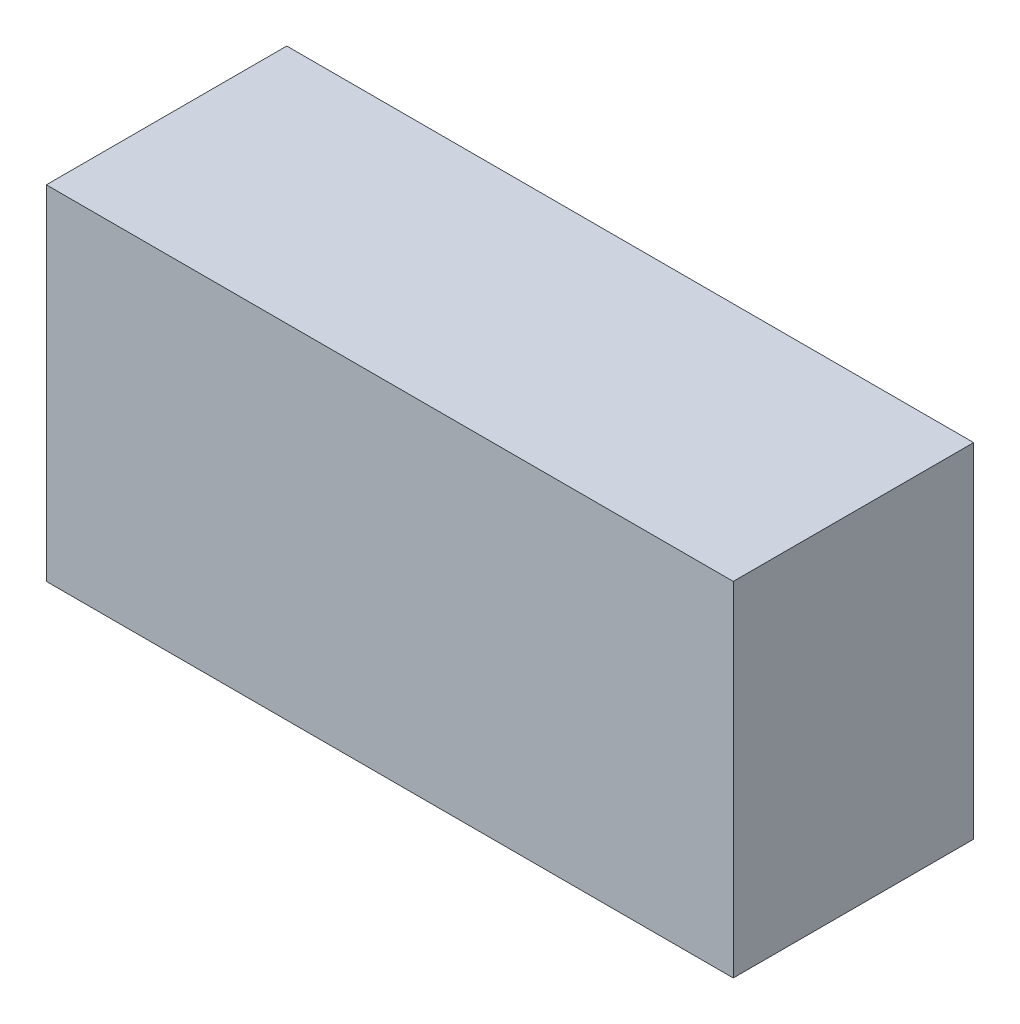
SolidWorks part; units mm, degrees
ref_plane "Face" through (0, 0, 0) normal (0, 0, 1) x (1, 0, 0)
ref_plane "Dessus" through (0, 0, 0) normal (0, 1, 0) x (1, 0, 0)
ref_plane "Droite" through (0, 0, 0) normal (1, 0, 0) x (0, 0, -1)
sketch "Esquisse1" plane through (0, 0, 0) normal (0, 0, 1) x (1, 0, 0)
  line L1 (0, 0) -> (100, 0)
  line L2 (0, 0) -> (0, 50)
  line L3 (0, 50) -> (100, 50)
  line L4 (100, 0) -> (100, 50)
  dimension "D1" = 100
  dimension "D2" = 50
extrude "Extrusion1" add sketch "Esquisse1" along normal blind 35
sketch "Esquisse3"
